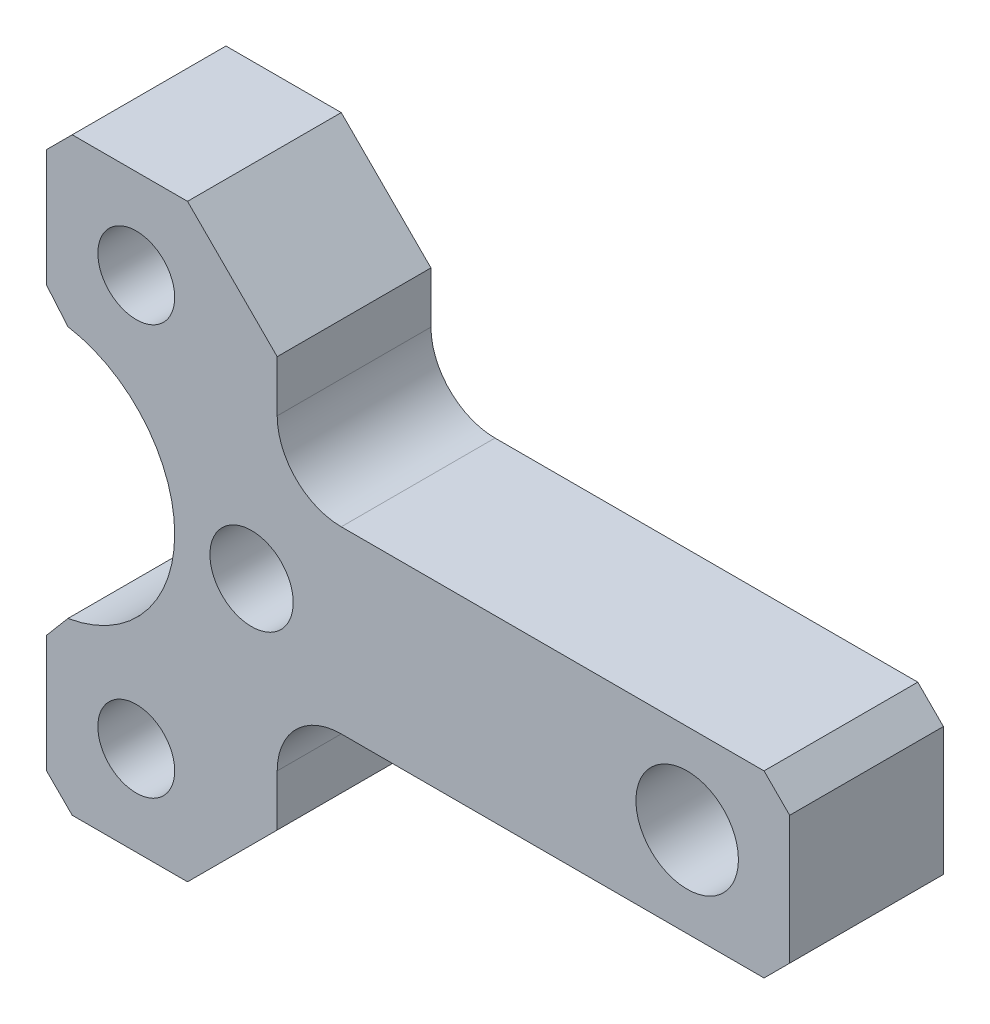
SolidWorks part; units mm, degrees
ref_plane "Plan1" through (0, 0, 0) normal (0, 0, 1) x (1, 0, 0)
ref_plane "Plan2" through (0, 0, 0) normal (0, 1, 0) x (1, 0, 0)
ref_plane "Plan3" through (0, 0, 0) normal (1, 0, 0) x (0, 0, -1)
sketch "Esquisse1" plane through (0, 0, 0) normal (0, 0, 1) x (1, 0, 0)
  line L0 (0, -23) -> (0, -10)
  line L1 (0, 23) -> (18, 23)
  line L2 (18, 23) -> (18, 12)
  line L3 (23, 7) -> (58, 7)
  line L4 (58, 7) -> (58, -7)
  line L5 (-23.2546, 0) -> (92.1572, 0) construction
  line L6 (23, -7) -> (58, -7)
  line L7 (18, -23) -> (18, -12)
  line L8 (0, -23) -> (18, -23)
  line L9 (0, 10) -> (0, 23)
  arc A0 (0, -10) -> (0, 10) centre (0, 0) ccw
  arc A1 (18, -12) -> (23, -7) centre (23, -12) cw
  arc A2 (18, 12) -> (23, 7) centre (23, 12) ccw
  point P11 (58, 0)
  point P17 (18, -7)
  point P20 (18, 7)
  dimension "D5" = 20
  dimension "D6" = 5
  dimension "D1" = 23
  dimension "D2" = 18
  dimension "D3" = 7
  dimension "D4" = 58
extrude "Base-Extrusion" add sketch "Esquisse1" along normal blind 12
chamfer "Chanfrein1" distance 7 angle 45
sketch "Esquisse2" plane through (0, 0, 12) normal (0, 0, 1) x (1, 0, 0)
  line L2 (23, -7) -> (58, -7) construction
  circle A0 centre (7, 16) radius 3
  circle A1 centre (7, -16) radius 3
  circle A2 centre (50, 0) radius 4
  arc A3 (0, -10) -> (0, 10) centre (0, 0) ccw construction
  circle A4 centre (16, 0) radius 3.25
  dimension "D1" = 6
  dimension "D2" = 6
  dimension "D3" = 8
  dimension "D4" = 32
  dimension "D5" = 16
  dimension "D6" = 7
  dimension "D7" = 50
  dimension "D9" = 6.5
  dimension "D10" = 16
  dimension "D8" = 7
extrude "Enlèv. mat.-Extru.1" cut sketch "Esquisse2" against normal through all
chamfer "Chanfrein2" distance 2 angle 45
